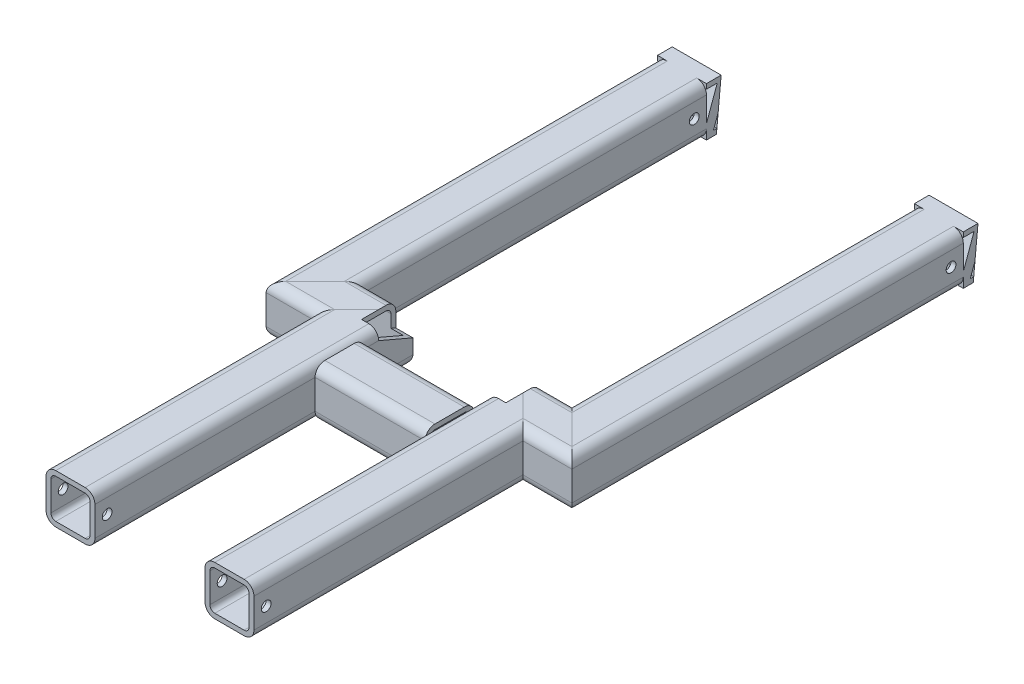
SolidWorks part; units mm, degrees
ref_plane "Front Plane" through (0, 0, 0) normal (0, 0, 1) x (1, 0, 0)
ref_plane "Top Plane" through (0, 0, 0) normal (0, 1, 0) x (1, 0, 0)
ref_plane "Right Plane" through (0, 0, 0) normal (1, 0, 0) x (0, 0, -1)
sketch "Sketch1" plane through (0, 0, 0) normal (0, 1, 0) x (1, 0, 0)
  line L0 (-89.1828, 0) -> (-44.1828, 0)
  line L2 (-34.1828, -100) -> (-34.1828, 20)
  line L4 (-99.1828, -100) -> (-99.1828, 20)
  line L5 (-99.1828, 20) -> (-119.1828, 20)
  line L6 (-119.1828, 20) -> (-119.1828, 170)
  line L7 (-34.1828, 20) -> (-14.1828, 20)
  line L8 (-14.1828, 20) -> (-14.1828, 170)
  point P0 (0, 0)
  dimension "D1" = 150
  dimension "D2" = 65
  dimension "D3" = 10
  dimension "D4" = 10
  dimension "D5" = 20
  dimension "D6" = 20
  dimension "D7" = 100
  dimension "D8" = 20
  dimension "D9" = 150
other "Square tube 20 X 20 X 2(3)"
ref_plane "Plane6" through (-119.1828, 0, -20) normal (0, 0, -1) x (-1, 0, 0)
sketch "Sketch16" plane through (-119.1828, 0, -20) normal (0, 0, -1) x (-1, 0, 0)
  line L0 (-6, -8) -> (6, -8)
  line L1 (-8, -6) -> (-8, 6)
  line L2 (6, 8) -> (-6, 8)
  line L3 (8, 6) -> (8, -6)
  line L4 (-6, -10) -> (6, -10)
  line L5 (-10, -6) -> (-10, 6)
  line L6 (6, 10) -> (-6, 10)
  line L7 (10, 6) -> (10, -6)
  arc A0 (10, 6) -> (6, 10) centre (6, 6) ccw
  arc A1 (6, -10) -> (10, -6) centre (6, -6) ccw
  arc A2 (-10, -6) -> (-6, -10) centre (-6, -6) ccw
  arc A3 (-6, 10) -> (-10, 6) centre (-6, 6) ccw
  arc A4 (-6, 8) -> (-8, 6) centre (-6, 6) ccw
  arc A5 (8, 6) -> (6, 8) centre (6, 6) ccw
  arc A6 (6, -8) -> (8, -6) centre (6, -6) ccw
  arc A7 (-8, -6) -> (-6, -8) centre (-6, -6) ccw
  point P0 (-10, 0)
  point P1 (10, 0)
  point P2 (0, 10)
  point P3 (0, -10)
  point P4 (0, 0)
  point P5 (-10, -10)
  point P6 (10, -10)
  point P7 (10, 10)
  point P8 (-10, 10)
  point P33 (0, 0)
  dimension "D1" = 4
  dimension "Thickness" = 2
  dimension "V_leg" = 20
sketch "Sketch18" plane through (-4.1828, 0, 0) normal (1, 0, 0) x (0, 0, -1)
  line L0 (20, 0) -> (170, 0) construction
  line L1 (170, 6) -> (170, -6) construction
  line L2 (-100, 0) -> (20, 0) construction
  line L3 (-100, 6) -> (-100, -6) construction
  circle A0 centre (165, 0) radius 2
  circle A1 centre (-95, 0) radius 2
  dimension "D1" = 4
  dimension "D3" = 4
  dimension "D2" = 5
  dimension "D4" = 5
extrude "Cut-Extrude2" cut sketch "Sketch18" against normal blind 130
sketch "Sketch19" plane through (-129.1828, 0, 0) normal (-1, 0, 0) x (0, 0, 1)
  line L1 (-170, -10) -> (-14, -10) construction
  line L2 (-170, -10) -> (-177.2794, 10)
  line L3 (-170, 10) -> (-14, 10) construction
  line L4 (-177.2794, 10) -> (-170, 10)
  line L5 (-175.151, 10) -> (-170, -4.1524)
  line L6 (-170, -10) -> (-170, -4.1524)
  line L7 (-176.5515, 8) -> (-170, 8)
  line L8 (-170, 8) -> (-170, 10)
  dimension "D1" = 110
  dimension "D2" = 2
  dimension "D3" = 2
extrude "Boss-Extrude1" add sketch "Sketch19" against normal blind 20 contours L2 L7 L5 L4 | L7 L8 L4 L5 | L7 L2 L6 L5 M10
sketch "Sketch20" plane through (-24.1828, 0, 0) normal (-1, 0, 0) x (0, 0, 1)
  line L0 (-176.5515, 8) -> (-170, 8) construction
  line L1 (-170, 8) -> (-170, 10) construction
  line L2 (-177.2794, 10) -> (-170, 10) construction
  line L3 (-170, -10) -> (-177.2794, 10) construction
  line L4 (-170, -10) -> (-170, -4.1524) construction
  line L5 (-175.151, 10) -> (-170, -4.1524) construction
  line L6 (-176.5515, 8) -> (-170, 8)
  line L7 (-170, 8) -> (-170, 10)
  line L8 (-177.2794, 10) -> (-170, 10)
  line L9 (-170, -10) -> (-177.2794, 10)
  line L10 (-170, -10) -> (-170, -4.1524)
  line L11 (-175.151, 10) -> (-170, -4.1524)
extrude "Boss-Extrude2" add sketch "Sketch20" against normal blind 20 contours L11 L6 L9 L10 M10 | L11 L8 L9 L6 | L8 L11 L6 L7
sketch "Sketch21" plane through (-129.1828, 0, 0) normal (-1, 0, 0) x (0, 0, 1)
  line L0 (-177.2794, 10) -> (-178.0194, 10)
  line L1 (-170, -10) -> (-176.08, -10)
  line L2 (-178.0194, 10) -> (-176.08, -10)
  line L3 (-170, -10) -> (-170.3554, -6.3345)
  line L4 (-170.3554, -6.3345) -> (-176.3007, 10)
  line L5 (-177.2794, 10) -> (-170, 10) construction
  line L6 (-176.3007, 10) -> (-177.2794, 10)
  line L7 (-174.2646, -8) -> (-172.8563, -8)
  line L8 (-172.8563, -8) -> (-174.776, -2.7256)
  line L10 (-174.2646, -8) -> (-174.776, -2.7256)
  line L11 (-170, -10) -> (-177.2794, 10) construction
  dimension "D1" = 0.74
  dimension "D2" = 6.08
  dimension "D3" = 2
  dimension "D4" = 2
  dimension "D5" = 2
extrude "Boss-Extrude3" add sketch "Sketch21" against normal blind 20
sketch "Sketch22" plane through (-24.1828, 0, 0) normal (-1, 0, 0) x (0, 0, 1)
  line L3 (-174.2646, -8) -> (-172.8563, -8)
  line L4 (-172.8563, -8) -> (-174.776, -2.7256)
  line L5 (-174.776, -2.7256) -> (-174.2646, -8)
  line L6 (-177.2794, 10) -> (-178.0194, 10)
  line L7 (-178.0194, 10) -> (-176.08, -10)
  line L8 (-176.08, -10) -> (-170, -10)
  line L9 (-170, -10) -> (-170.3554, -6.3345)
  line L10 (-170.3554, -6.3345) -> (-176.3007, 10)
  line L11 (-176.3007, 10) -> (-177.2794, 10)
  line L12 (-177.2794, 10) -> (-178.0194, 10)
  line L13 (-178.0194, 10) -> (-176.08, -10)
  line L14 (-176.08, -10) -> (-170, -10)
  line L15 (-170, -10) -> (-170.3554, -6.3345)
  line L16 (-170.3554, -6.3345) -> (-176.3007, 10)
  line L17 (-176.3007, 10) -> (-177.2794, 10)
  line L18 (-174.2646, -8) -> (-172.8563, -8)
  line L19 (-172.8563, -8) -> (-174.776, -2.7256)
  line L20 (-174.776, -2.7256) -> (-174.2646, -8)
  dimension "D1" = 0
  dimension "D2" = 0
sketch "Sketch26" plane through (-89.1828, 0, 0) normal (1, 0, 0) x (0, 0, -1)
  line L0 (16, 6) -> (30, 0)
  line L1 (30, 6) -> (-100, 6) construction
  line L2 (30, -6) -> (30, 6) construction
  line L3 (30, 0) -> (30, 12.407)
  line L4 (30, 12.407) -> (16, 12.407)
  line L5 (16, 12.407) -> (16, 6)
  dimension "D1" = 14
extrude "Cut-Extrude5" cut sketch "Sketch26" against normal blind 7 and the other way blind 52
extrude "Boss-Extrude4" add sketch "Sketch22" against normal blind 20
sketch "Sketch23" plane through (-129.1828, 0, 0) normal (-1, 0, 0) x (0, 0, 1)
  line L0 (-176.363, 13.5722) -> (-173.6084, -14.8344)
  line L1 (-173.6084, -14.8344) -> (-181.5587, -15.4641)
  line L2 (-181.5587, -15.4641) -> (-184.3743, 13.5722)
  line L3 (-184.3743, 13.5722) -> (-176.363, 13.5722)
  line L4 (-178.0194, 10) -> (-176.08, -10) construction
  line L5 (-166.6178, 16.6831) -> (-163.3822, -16.6831)
  circle A0 centre (-165, 0) radius 2 construction
  circle A1 centre (-165, 0) radius 2
  point P11 (-165, 0)
  dimension "D1" = 10
extrude "Cut-Extrude4" cut sketch "Sketch23" against normal blind 130 contours L2 L3 L0 L1
